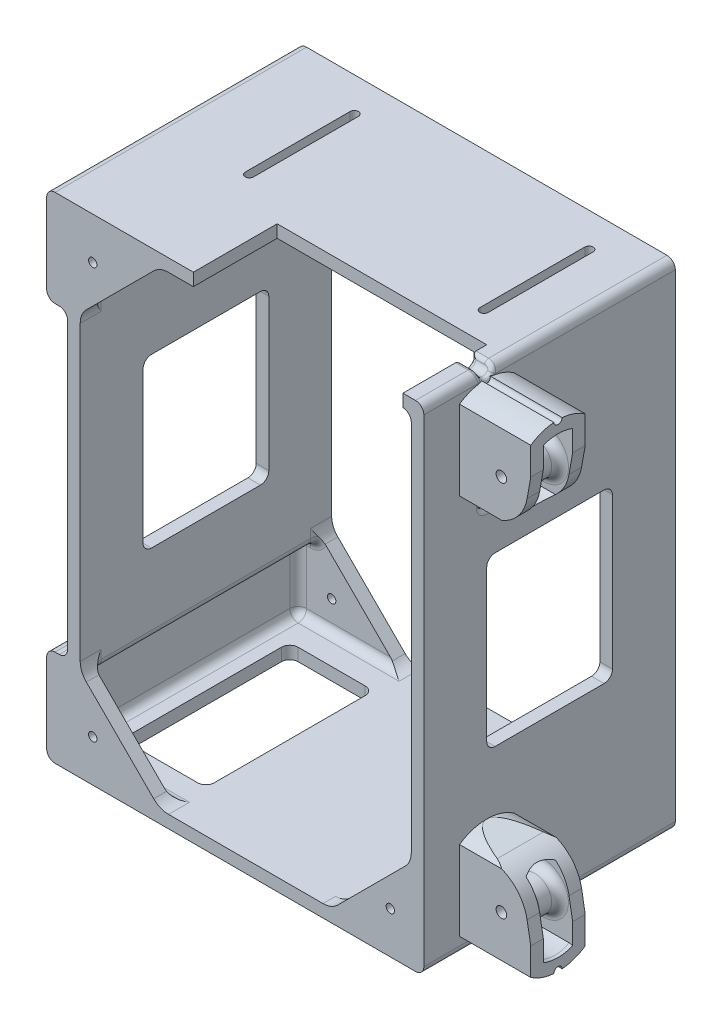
SolidWorks part; units mm, degrees
ref_plane "Plan de face" through (0, 0, 0) normal (0, 0, 1) x (1, 0, 0)
ref_plane "Plan de dessus" through (0, 0, 0) normal (0, 1, 0) x (1, 0, 0)
ref_plane "Plan de droite" through (0, 0, 0) normal (1, 0, 0) x (0, 0, -1)
sketch "Esquisse1" plane through (0, 0, 0) normal (0, 0, 1) x (1, 0, 0)
  line L0 (-3, 115) -> (-87, 115)
  line L1 (0, 0) -> (-90, 0)
  line L2 (0, 0) -> (0, 118)
  line L3 (0, 118) -> (-90, 118)
  line L4 (-90, 0) -> (-90, 20)
  line L5 (-87, 3) -> (-87, 20)
  line L6 (-3, 3) -> (-87, 3)
  line L7 (-3, 3) -> (-3, 115)
  line L8 (-90, 98) -> (-87, 98)
  line L9 (-90, 20) -> (-87, 20)
  line L10 (-87, 98) -> (-87, 115)
  line L11 (-90, 98) -> (-90, 118)
  line L12 (-87, 3) -> (-87, 115) construction
  line L14 (-90, 0) -> (-90, 118) construction
  dimension "D1" = 90
  dimension "D2" = 118
  dimension "D4" = 20
  dimension "D5" = 20
  dimension "D3" = 3
extrude "Boss.-Extru.2" add sketch "Esquisse1" along normal blind 60 contours L3 L11 L8 L10 L0 L7 L6 L5 L9 L4 L1 L2
ref_plane "Plan1" through (0, 0, 45) normal (0, 0, 1) x (1, 0, 0)
sketch "Esquisse2" plane through (0, 0, 0) normal (1, 0, 0) x (0, 0, -1)
  line L0 (-48.5, 112.246) -> (-48.5, 96.754)
  line L1 (-45, 84.9462) -> (-45, 52.4993) construction
  line L2 (-51.5, 113.9868) -> (-51.5, 95.0132)
  line L3 (-60, 0) -> (-60, 118) construction
  line L4 (-38.5, 113.9868) -> (-38.5, 95.0132)
  line L5 (-60, 118) -> (0, 118) construction
  line L6 (-76.0782, 45) -> (5.983, 45) construction
  line L7 (-41.5, 112.246) -> (-41.5, 96.754)
  line L10 (-81.25, 104.5) -> (-8.75, 104.5) construction
  arc A0 (-41.5, 96.754) -> (-48.5, 96.754) centre (-45, 104.5) cw
  arc A1 (-38.5, 113.9868) -> (-44.0009, 115.9565) centre (-45, 104.5) ccw
  arc A2 (-41.5, 112.246) -> (-48.5, 112.246) centre (-45, 104.5) ccw
  arc A3 (-45.9991, 115.9565) -> (-44.0009, 115.9565) centre (-45, 116) ccw
  arc A4 (-45.9991, 115.9565) -> (-51.5, 113.9868) centre (-45, 104.5) ccw
  arc A6 (-38.5, 113.9868) -> (-51.5, 113.9868) centre (-45, 104.5) ccw construction
  arc A7 (-38.5, 95.0132) -> (-51.5, 95.0132) centre (-45, 104.5) cw
  point P14 (-48.75, 57.5)
  point P16 (-61.25, 57.5)
extrude "Boss.-Extru.4" add sketch "Esquisse2" along normal blind 18.5
sketch "Esquisse5" plane through (0, 0, 45) normal (0, 0, 1) x (1, 0, 0)
  line L1 (0, 0) -> (0, 118) construction
  circle A0 centre (10, 104) radius 1.25
  point P6 (0, 59)
  dimension "D1" = 2.5
  dimension "D3" = 10
extrude "Enlèv. mat.-Extru.2" cut sketch "Esquisse5" against normal through all and the other way through all
sketch "Esquisse8" plane through (0, 0, 45) normal (0, 0, 1) x (1, 0, 0)
  circle A0 centre (10, 104) radius 4
  dimension "D1" = 8
extrude "Boss.-Extru.6" add sketch "Esquisse8" along normal up to surface and the other way up to surface
fillet "Congé3" radius 2 2 edges at (6, 104, 48.5) (14, 104, 41.5)
ref_plane "Plan2" through (0, 59, 0) normal (0, -1, 0) x (-1, 0, 0)
sketch "Esquisse9" plane through (0, 0, 60) normal (0, 0, 1) x (1, 0, 0)
  line L0 (-87, 98) -> (-82, 98)
  line L1 (-82, 98) -> (-82, 20)
  line L2 (-82, 20) -> (-87, 20)
  line L3 (-90, 20) -> (-90, 23)
  line L4 (-90, 23) -> (-85, 23)
  line L5 (-85, 23) -> (-85, 95)
  line L6 (-85, 95) -> (-90, 95)
  line L7 (-90, 95) -> (-90, 98)
  line L8 (-90, 98) -> (-87, 98)
  line L9 (-87, 20) -> (-90, 20)
  line L10 (-87, 98) -> (-87, 115) construction
  dimension "D1" = 3
  dimension "D2" = 3
  dimension "D3" = 3
  dimension "D4" = 5
extrude "Boss.-Extru.7" add sketch "Esquisse9" against normal up to surface (60 mm away)
sketch "Esquisse10" plane through (0, 0, 0) normal (0, -1, 0) x (1, 0, 0)
  line L0 (-82, 0) -> (-82, 60) construction
  line L1 (-82, 50) -> (-62, 50)
  line L2 (-82, 50) -> (-82, 10)
  line L3 (-82, 10) -> (-62, 10)
  line L4 (-62, 50) -> (-62, 10)
  line L5 (-90, 60) -> (-90, 0) construction
  point P8 (-90, 30)
extrude "Enlèv. mat.-Extru.3" cut sketch "Esquisse10" against normal up to next
sketch "Esquisse11" plane through (0, 118, 0) normal (0, 1, 0) x (1, 0, 0)
  line L0 (0, -60) -> (-90, -60) construction
  line L1 (-5, -60) -> (-55, -60)
  line L2 (-5, -60) -> (-5, -40)
  line L3 (-5, -40) -> (-55, -40)
  line L4 (-55, -60) -> (-55, -40)
  line L5 (0, -60) -> (0, 0) construction
  dimension "D1" = 20
  dimension "D2" = 50
  dimension "D3" = 5
extrude "Enlèv. mat.-Extru.4" cut sketch "Esquisse11" against normal up to next
sketch "Esquisse12" plane through (0, 0, 0) normal (1, 0, 0) x (0, 0, -1)
  line L2 (-30, 118) -> (-30, 0) construction
  line L3 (-60, 118) -> (0, 118) construction
  line L4 (-60, 0) -> (0, 0) construction
  line L6 (-45, 39) -> (-15, 39)
  line L7 (-45, 39) -> (-45, 79)
  line L8 (-45, 79) -> (-15, 79)
  line L9 (-15, 39) -> (-15, 79)
  line L10 (-45, 39) -> (-15, 79) construction
  line L11 (-45, 79) -> (-15, 39) construction
  point P0 (-30, 59)
  dimension "D1" = 40
  dimension "D2" = 30
extrude "Enlèv. mat.-Extru.5" cut sketch "Esquisse12" against normal through all
sketch "Esquisse13" plane through (0, 0, 0) normal (1, 0, 0) x (0, 0, -1)
  line L0 (-46.5, 104) -> (-43.5, 104) construction
  line L1 (-64.8515, 104) -> (-44.7368, 104) construction
  line L2 (-48.5, 104) -> (-51.5, 104) construction
  line L3 (-45, 121.2099) -> (-45, 85.4835) construction
  line L4 (-45, 38.5) -> (-45, -38.5) construction
  circle A0 centre (-45, 90.5) radius 1.5
  circle A1 centre (-45, 117.5) radius 1.5
  dimension "D1" = 3
  dimension "D2" = 13.5
extrude "Enlèv. mat.-Extru.6" cut sketch "Esquisse13" against normal up to next and the other way through all
fillet "Congé4" radius 2 29 edges at (-3, 3, 30) (-87, 3, 30) (-87, 20, 30) (-85, 23, 30) (-85, 95, 30) (-87, 98, 30) (-87, 115, 30) (-3, 115, 30) (0, 0, 30) (-90, 0, 30) (-82, 20, 30) (-90, 23, 30) (-90, 95, 30) (-90, 118, 30) (0, 118, 21.7929) (0, 118, 53.2071) (-82, 98, 30) (-62, 1.5, 50) (-82, 1.5, 50) (-62, 1.5, 10) (-82, 1.5, 10) (-83.5, 39, 15) (-83.5, 39, 45) (-83.5, 79, 45) (-83.5, 79, 15) (-1.5, 79, 15) (-1.5, 79, 45) (-1.5, 39, 45) (-1.5, 39, 15)
sketch "Esquisse14" plane through (0, 0, 0) normal (0, 0, -1) x (-1, 0, 0)
  line L0 (85, 93) -> (-3.2573, 93) construction
  line L2 (85, 93) -> (60, 118)
  line L3 (-18.5, 93) -> (0, 93) construction
  line L4 (0, 93) -> (25, 118)
  line L5 (0, 59) -> (87, 59) construction
  line L6 (-49.5094, 59) -> (49.5094, 59) construction
  line L7 (85, 25) -> (60, 0)
  line L8 (0, 116) -> (0, 2)
  line L9 (2, 0) -> (88, 0)
  line L10 (90, 2) -> (90, 21)
  line L11 (88, 23) -> (87, 23)
  line L12 (85, 25) -> (85, 93)
  line L13 (87, 95) -> (88, 95)
  line L14 (90, 97) -> (90, 116)
  line L15 (88, 118) -> (2, 118)
  line L16 (0, 116) -> (0, 93)
  line L17 (2, 0) -> (25, 0)
  line L18 (90, 2) -> (90, 21)
  line L19 (88, 23) -> (87, 23)
  line L21 (87, 95) -> (88, 95)
  line L22 (90, 97) -> (90, 116)
  line L23 (88, 118) -> (60, 118)
  line L24 (0, 25) -> (25, 0)
  line L25 (25, 118) -> (2, 118)
  line L26 (0, 25) -> (0, 2)
  line L27 (60, 0) -> (88, 0)
  circle A0 centre (79, 108) radius 1
  circle A1 centre (8, 108) radius 1
  circle A2 centre (79, 10) radius 1
  circle A3 centre (8, 10) radius 1
  arc A8 (0, 2) -> (2, 0) centre (2, 2) ccw
  arc A9 (88, 0) -> (90, 2) centre (88, 2) ccw
  arc A10 (90, 21) -> (88, 23) centre (88, 21) ccw
  arc A11 (85, 25) -> (87, 23) centre (87, 25) ccw
  arc A12 (87, 95) -> (85, 93) centre (87, 93) ccw
  arc A13 (88, 95) -> (90, 97) centre (88, 97) ccw
  arc A14 (90, 116) -> (88, 118) centre (88, 116) ccw
  arc A15 (2, 118) -> (0, 116) centre (2, 116) ccw
  arc A16 (0, 2) -> (2, 0) centre (2, 2) ccw
  arc A17 (88, 0) -> (90, 2) centre (88, 2) ccw
  arc A18 (90, 21) -> (88, 23) centre (88, 21) ccw
  arc A19 (85, 25) -> (87, 23) centre (87, 25) ccw
  arc A20 (87, 95) -> (85, 93) centre (87, 93) ccw
  arc A21 (88, 95) -> (90, 97) centre (88, 97) ccw
  arc A22 (90, 116) -> (88, 118) centre (88, 116) ccw
  arc A23 (2, 118) -> (0, 116) centre (2, 116) ccw
  dimension "D4" = 2
  dimension "D6" = 10
  dimension "D7" = 2
  dimension "D8" = 8
  dimension "D9" = 10
  dimension "D2" = 45
  dimension "D3" = 45
  dimension "D5" = 11
  dimension "D1" = 0
extrude "Boss.-Extru.8" add sketch "Esquisse14" against normal blind 3
pattern_linear "Répétition linéaire1" count 2 spacing 57 along (0, 0, 1) of "Boss.-Extru.8"
sketch "Esquisse15" plane through (0, 0, 57) normal (0, 0, -1) x (-1, 0, 0)
  line L4 (5, 118) -> (5, 115)
  line L5 (3, 113) -> (3, 96)
  line L6 (3, 96) -> (25, 118)
  line L7 (25, 118) -> (5, 118)
  line L8 (5, 118) -> (5, 115)
  line L9 (3, 113) -> (3, 96)
  line L10 (3, 96) -> (25, 118)
  line L11 (25, 118) -> (5, 118)
  arc A1 (5, 115) -> (3, 113) centre (5, 113) ccw
  arc A2 (5, 115) -> (3, 113) centre (5, 113) ccw
  dimension "D1" = 0
extrude "Enlèv. mat.-Extru.7" cut sketch "Esquisse15" against normal through all
sketch "Esquisse16" plane through (0, 0, 45) normal (0, 0, 1) x (1, 0, 0)
  line L0 (18.5, 115.95) -> (16.133, 102.526)
  line L1 (8.0214, 94.4144) -> (0, 93)
  line L2 (18.5, 113.9868) -> (18.5, 95.0132) construction
  line L3 (0, 93) -> (18.5, 93) construction
  line L4 (18.5, 115.95) -> (18.5, 93)
  line L5 (18.5, 93) -> (0, 93)
  arc A0 (16.133, 102.526) -> (8.0214, 94.4144) centre (6.2849, 104.2625) cw
  dimension "D1" = 10
  dimension "D2" = 10
  dimension "D3" = 10
extrude "Enlèv. mat.-Extru.8" cut sketch "Esquisse16" against normal through all both and the other way through all
sketch "Esquisse17" plane through (0, 0, 0) normal (1, 0, 0) x (0, 0, -1)
  line L4 (-41.5, 96.754) -> (-41.5, 112.246)
  line L5 (-41.5, 96.754) -> (-41.5, 112.246)
  line L6 (-48.5, 112.246) -> (-48.5, 96.754)
  line L7 (-48.5, 112.246) -> (-48.5, 96.754)
  arc A4 (-41.5, 112.246) -> (-48.5, 112.246) centre (-45, 104.5) ccw
  arc A5 (-41.5, 112.246) -> (-48.5, 112.246) centre (-45, 104.5) ccw
  arc A6 (-48.5, 96.754) -> (-41.5, 96.754) centre (-45, 104.5) ccw
  arc A7 (-48.5, 96.754) -> (-41.5, 96.754) centre (-45, 104.5) ccw
  dimension "D1" = 0
extrude "Enlèv. mat.-Extru.9" cut sketch "Esquisse17" against normal up to next
mirror "Symétrie3" about plane through (0, 59, 0) normal (0, -1, 0) of "Enlèv. mat.-Extru.8", "Enlèv. mat.-Extru.9", "Congé3", "Enlèv. mat.-Extru.2", "Boss.-Extru.4", "Boss.-Extru.6"
fillet "Congé5" radius 5 14 edges at (-82, 96, 58.5) (-63, 115, 58.5) (-82, 96, 1.5) (-63, 115, 1.5) (-22, 115, 1.5) (-3, 96, 1.5) (-63, 3, 58.5) (-82, 22, 58.5) (-82, 22, 1.5) (-63, 3, 1.5) (-22, 3, 1.5) (-22, 3, 58.5) (-3, 22, 58.5) (-3, 22, 1.5)
fillet "Congé6" radius 2 38 edges at (-3, 14.5355, 3) (-3.5858, 3.5858, 3) (-3, 103.4645, 3) (-3.5858, 114.4142, 3) (-82, 94.9645, 3) (-82.5858, 97.4142, 3) (-84.5, 98, 3) (-86.4142, 98.5858, 3) (-87, 106.5, 3) (-86.4142, 114.4142, 3) (-82, 94.9645, 57) (-82.5858, 97.4142, 57) (-84.5, 98, 57) (-86.4142, 98.5858, 57) (-87, 106.5, 57) (-86.4142, 114.4142, 57) (-14.5355, 3, 3) (-14.5355, 115, 3) (-72.9645, 115, 3) (-72.9645, 115, 57) (-82, 23.0355, 57) (-82.5858, 20.5858, 57) (-84.5, 20, 57) (-86.4142, 19.4142, 57) (-72.9645, 3, 57) (-86.4142, 3.5858, 57) (-87, 11.5, 57) (-82, 23.0355, 3) (-82.5858, 20.5858, 3) (-84.5, 20, 3) (-86.4142, 19.4142, 3) (-87, 11.5, 3) (-86.4142, 3.5858, 3) (-72.9645, 3, 3) (17.9798, 113, 45) (17.9798, 5, 45) (-3, 22, 45) (-3, 96, 45)
sketch "Esquisse18" plane through (0, 115, 0) normal (0, -1, 0) x (1, 0, 0)
  line L0 (-5, 3) -> (-20, 3) construction
  line L1 (-5, 40) -> (-55, 40) construction
  line L2 (-8, 40) -> (-3, 40)
  line L3 (-8, 40) -> (-8, 3)
  line L4 (-8, 3) -> (-3, 3)
  line L5 (-3, 40) -> (-3, 3)
  line L7 (-3, 45) -> (-3, 5) construction
  dimension "D1" = 5
  dimension "D2" = 5
extrude "Boss.-Extru.9" add sketch "Esquisse18" along normal blind 2
fillet "Congé7" radius 2 3 edges at (-6.5, 113, 3) (-3.5858, 113, 3.5858) (-3, 113, 22.5)
sketch "Esquisse19" plane through (0, 118, 0) normal (0, 1, 0) x (1, 0, 0)
  line L0 (-68.5, -38.5217) -> (-68.5, -3.2296) construction
  line L1 (-12.5, -38.5217) -> (-12.5, -3) construction
  line L2 (-12.5, -33.1377) -> (-12.5, -8.106) construction
  line L3 (-13.5, -33.1377) -> (-13.5, -8.106)
  line L4 (-11.5, -33.1377) -> (-11.5, -8.106)
  line L5 (-68.5, -33.1377) -> (-68.5, -8.106) construction
  line L9 (-69.5, -33.1377) -> (-69.5, -8.106)
  line L10 (-8, -3) -> (-20, -3) construction
  line L12 (-67.5, -33.1377) -> (-67.5, -8.106)
  arc A0 (-13.5, -33.1377) -> (-11.5, -33.1377) centre (-12.5, -33.1377) ccw
  arc A1 (-11.5, -8.106) -> (-13.5, -8.106) centre (-12.5, -8.106) ccw
  arc A2 (-69.5, -33.1377) -> (-67.5, -33.1377) centre (-68.5, -33.1377) ccw
  arc A3 (-67.5, -8.106) -> (-69.5, -8.106) centre (-68.5, -8.106) ccw
  point P8 (-12.5, -20.6219)
  point P17 (-68.5, -20.6219)
  dimension "D1" = 1
  dimension "D2" = 2
extrude "Enlèv. mat.-Extru.10" cut sketch "Esquisse19" against normal up to next
fillet "Congé8" radius 1 1 edges at (18.3325, 115, 45)
fillet "Congé9" radius 1 7 edges at (-3.5, 118, 46.4142) (-0.1314, 116.7129, 46.2769) (-3.5, 118, 43.5858) (-0.2989, 117.0518, 43.5685) (-5, 116, 45) (0, 90.5, 46.5) (-3, 90.5, 46.5)
sketch "Esquisse20" plane through (0, 0, 45) normal (0, 0, 1) x (1, 0, 0)
  line L1 (17, 118.6789) -> (31.4716, 118.6789)
  line L2 (17, 118.6789) -> (17, -11.9808)
  line L3 (17, -11.9808) -> (31.4716, -11.9808)
  line L4 (31.4716, 118.6789) -> (31.4716, -11.9808)
  dimension "D1" = 7
extrude "Enlèv. mat.-Extru.11" cut sketch "Esquisse20" against normal through all both and the other way through all
equation "\"D4@Esquisse2\"=\"D2@Esquisse2\"/2"
equation "\"D2@Esquisse10\"=\"D1@Esquisse10\"/2"
